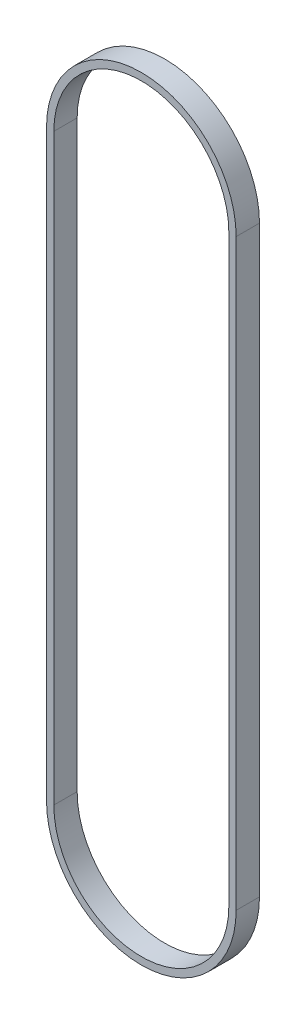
SolidWorks part; units mm, degrees
ref_plane "Plan de face" through (0, 0, 0) normal (0, 0, 1) x (1, 0, 0)
ref_plane "Plan de dessus" through (0, 0, 0) normal (0, 1, 0) x (1, 0, 0)
ref_plane "Plan de droite" through (0, 0, 0) normal (1, 0, 0) x (0, 0, -1)
sketch "Esquisse1" plane through (0, 0, 0) normal (0, 0, 1) x (1, 0, 0)
  line L0 (60, 0) -> (60, -400)
  line L1 (-60, 0) -> (-60, -400)
  line L2 (65, 0) -> (65, -400)
  line L3 (-65, 0) -> (-65, -400)
  arc A0 (60, 0) -> (-60, 0) centre (0, 0) ccw
  arc A1 (-60, -400) -> (60, -400) centre (0, -400) ccw
  arc A2 (-65, -400) -> (65, -400) centre (0, -400) ccw
  arc A3 (65, 0) -> (-65, 0) centre (0, 0) ccw
  dimension "D2" = 120
  dimension "D3" = 120
  dimension "D1" = 400
  dimension "D4" = 5
extrude "Extrusion1" add sketch "Esquisse1" along normal blind 16
